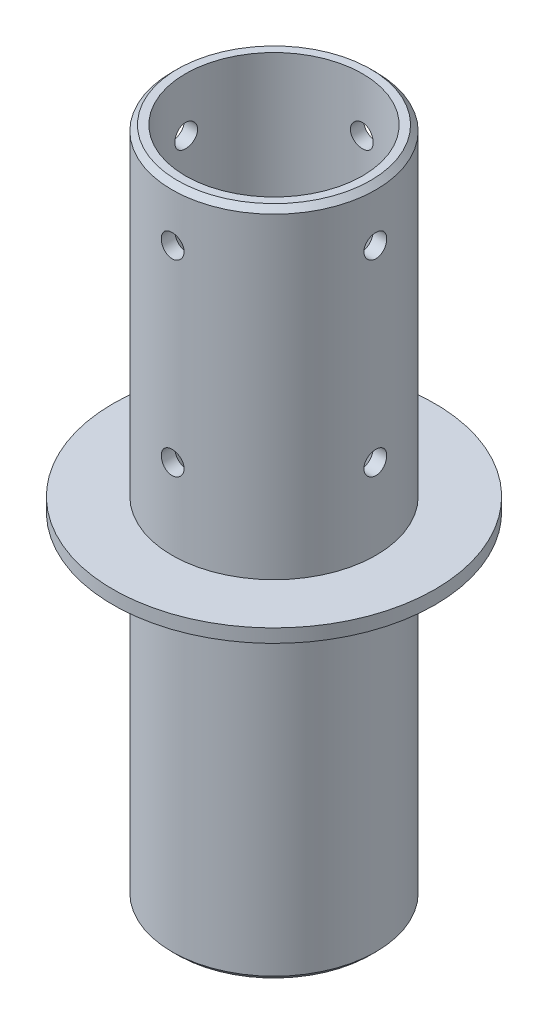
SolidWorks part; units mm, degrees
ref_plane "Plan de face" through (0, 0, 0) normal (0, 0, 1) x (1, 0, 0)
ref_plane "Plan de dessus" through (0, 0, 0) normal (0, 1, 0) x (1, 0, 0)
ref_plane "Plan de droite" through (0, 0, 0) normal (1, 0, 0) x (0, 0, -1)
sketch "Esquisse1" plane through (0, 0, 0) normal (0, 0, 1) x (1, 0, 0)
  line L0 (33, 0) -> (38, 0)
  line L4 (38, 0) -> (38, 250)
  line L10 (0, 3115.5399) -> (0, -377.5747) construction
  line L11 (33, 0) -> (33, 250)
  line L12 (38, 250) -> (33, 250)
  dimension "D2" = 250
  dimension "D4" = 76
  dimension "D9" = 5
revolve "tube" add sketch "Esquisse1" angle 360 about L10
hole_wizard "Trou taraudé M101" positions "Esquisse4" profile "Esquisse3" tap size "M10" standard "Iso"
sketch "Esquisse4" plane through (0, 0, 0) normal (0, 0, 1) x (1, 0, 0)
  line L0 (0, 0) -> (0, 250) construction
  line L1 (38, 250) -> (-38, 250) construction
  point P0 (0, 230)
  point P4 (0, 160)
  dimension "D1" = 20
  dimension "D2" = 70
sketch "Esquisse3" plane through (0, 230, 0) normal (1, 0, 0) x (0, 1, 0)
  line L0 (0, 0) -> (0, 38.001)
  line L1 (0, 38.001) -> (4.25, 38.001)
  line L2 (4.25, 38.001) -> (4.25, 0)
  line L5 (4.25, 0) -> (0, 0)
  line L11 (0, -6.35) -> (0, 107.95) construction
  dimension "Diamètre du trou pour taraudage jusqu'au prochain" = 8.5
  dimension "Profondeur du trou pour taraudage jusqu'au prochain" = 38.001
pattern_circular "Répétition circulaire1" count 4 every 90 about axis through (0, 3115.5399, 0) along (0, 1, 0) of "Trou taraudé M101"
chamfer "Chanfrein1" distance 2 angle 45 2 edges at (-38, 0, 0) (-38, 250, 0)
sketch "Esquisse5" plane through (0, 0, 0) normal (0, 0, 1) x (1, 0, 0)
  line L0 (-38, 155.75) -> (-38, 2) construction
  line L1 (-38, 125) -> (-60, 125)
  line L2 (-38, 125) -> (-38, 130)
  line L3 (-38, 130) -> (-60, 130)
  line L4 (-60, 125) -> (-60, 130)
  line L5 (0, 2) -> (0, 248) construction
  line L6 (33, 250) -> (-33, 250) construction
  dimension "D1" = 5
  dimension "D2" = 60
  dimension "D3" = 120
revolve "Collerette" add sketch "Esquisse5" angle 360 about axis through (0, 3115.5399, 0) along (0, 1, 0)
